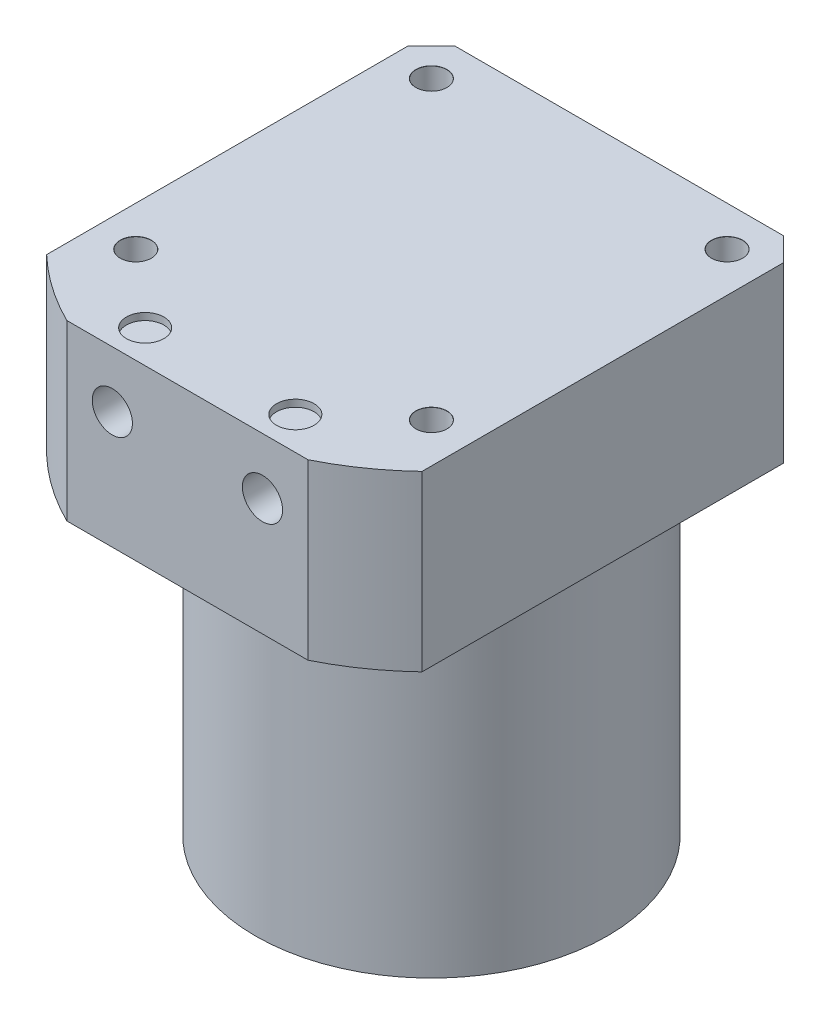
SolidWorks part; units mm, degrees
ref_plane "Front Plane" through (0, 0, 0) normal (0, 0, 1) x (1, 0, 0)
ref_plane "Top Plane" through (0, 0, 0) normal (0, 1, 0) x (1, 0, 0)
ref_plane "Right Plane" through (0, 0, 0) normal (1, 0, 0) x (0, 0, -1)
sketch "Sketch1" plane through (0, 0, 0) normal (0, 0, 1) x (1, 0, 0)
  line L0 (0, 87.0508) -> (0, 0) construction
  line L1 (0, 0) -> (-37.5, 0)
  line L2 (-37.5, 0) -> (-37.5, 71)
  line L3 (-37.5, 71) -> (-58, 71)
  line L4 (-58, 71) -> (-58, 108)
  line L6 (-58, 108) -> (0, 108)
  line L7 (0, 0) -> (0, 108)
  dimension "D1" = 37.5
  dimension "D2" = 71
  dimension "D3" = 58
  dimension "D5" = 37
revolve "Revolve1" add sketch "Sketch1" angle 360 about L0
sketch "Sketch2" plane through (0, 108, 0) normal (0, 1, 0) x (1, 0, 0)
  line L0 (0, 0) -> (0, 40) construction
  line L1 (-40, 40) -> (40, 40)
  line L2 (-40, 40) -> (-40, -52)
  line L3 (-40, -52) -> (40, -52)
  line L4 (40, 40) -> (40, -52)
  dimension "D1" = 92
  dimension "D2" = 80
  dimension "D3" = 40
extrude "Cut-Extrude2" cut sketch "Sketch2" against normal through all flip side to cut
chamfer "Chamfer1" distance 5 angle 45 2 edges at (40, 89.5, -40) (-40, 89.5, -40)
hole_wizard "Ø8.0 (8) Diameter Hole1" positions "Sketch4" profile "Sketch3" hole size "Ø8.0" standard "ISO"
sketch "Sketch4" plane through (-22.9405, 108, 22.7051) normal (0, -1, 0) x (1, 0, 0)
  line L0 (6.9405, 22.2949) -> (38.9405, 22.2949) construction
  line L2 (22.9405, 22.2949) -> (22.9405, -22.7051) construction
  point P0 (6.9405, 22.2949)
  point P1 (38.9405, 22.2949)
  dimension "D1" = 32
  dimension "D2" = 45
sketch "Sketch3" plane through (-16, 108, 45) normal (1, 0, 0) x (0, 0, 1)
  line L0 (0, 0) -> (0, 1.5)
  line L1 (0, 1.5) -> (4, 1.5)
  line L2 (4, 1.5) -> (4, 0)
  line L5 (4, 0) -> (0, 0)
  line L10 (0, 1.5) -> (-4, 1.5) construction
  line L11 (0, -6.35) -> (0, 107.95) construction
  dimension "Hole Dia." = 8
  dimension "Hole Depth" = 1.5
  dimension "Drill Angle" = 180
hole_wizard "G1/8 Tapped Hole1" positions "Sketch6" profile "Sketch5" tap size "G1/8" standard "ISO"
sketch "Sketch6" plane through (0, 0, 52) normal (0, 0, 1) x (1, 0, 0)
  line L0 (-16, 96) -> (16, 96) construction
  line L4 (0, 96) -> (0, 108) construction
  line L5 (-25.6905, 108) -> (25.6905, 108) construction
  point P0 (-16, 96)
  point P1 (16, 96)
  dimension "D1" = 12
  dimension "D2" = 32
sketch "Sketch5" plane through (-16, 96, 52) normal (1, 0, 0) x (0, -1, 0)
  line L0 (0, 0) -> (0, 22.18)
  line L1 (0, 22.18) -> (4.283, 22.18)
  line L2 (4.283, 22.18) -> (4.283, 0)
  line L5 (4.283, 0) -> (0, 0)
  line L10 (0, 22.18) -> (-4.283, 22.18) construction
  line L11 (0, -6.35) -> (0, 107.95) construction
  dimension "Tap Drill Dia." = 8.566
  dimension "Tap Drill Depth" = 22.18
  dimension "Drill Angle" = 180
hole_wizard "CBORE for M6 Hex Socket Head Cap Screw1" positions "Sketch8" profile "Sketch7" counterbore size "M6" standard "ISO"
sketch "Sketch8" plane through (-33.2535, 71, 49.2524) normal (0, 1, 0) x (-1, 0, 0)
  line L1 (-1.7535, -17.7524) -> (-64.7535, -17.7524)
  line L2 (-1.7535, -17.7524) -> (-1.7535, -80.7524)
  line L3 (-1.7535, -80.7524) -> (-64.7535, -80.7524)
  line L4 (-64.7535, -17.7524) -> (-64.7535, -80.7524)
  line L7 (-33.2535, -49.2524) -> (-33.2535, -17.7524) construction
  line L9 (-33.2535, -49.2524) -> (-1.7535, -49.2524) construction
  point P0 (-1.7535, -80.7524)
  point P1 (-64.7535, -80.7524)
  point P3 (-64.7535, -17.7524)
  point P5 (-1.7535, -17.7524)
  dimension "D1" = 63
  dimension "D2" = 63
sketch "Sketch7" plane through (-31.5, 71, -31.5) normal (1, 0, 0) x (0, 0, -1)
  line L0 (0, 0) -> (0, 37)
  line L1 (3.3, 36.975) -> (3.325, 37)
  line L2 (3.3, 36.975) -> (3.3, 6)
  line L3 (3.3, 6) -> (5.5, 6)
  line L4 (5.5, 6) -> (5.5, 0)
  line L5 (5.5, 0) -> (0, 0)
  line L11 (0, -6.35) -> (0, 107.95) construction
  line L12 (3.325, 37) -> (0, 37)
  line L13 (-3.3, 36.975) -> (-3.325, 37) construction
  dimension "Thru Hole Dia." = 6.6
  dimension "Thru Hole Depth" = 37
  dimension "C'Bore Dia." = 11
  dimension "C'Bore Depth" = 6
  dimension "Far C'Sink Dia." = 6.65
  dimension "Far C'Sink Angle" = 90
